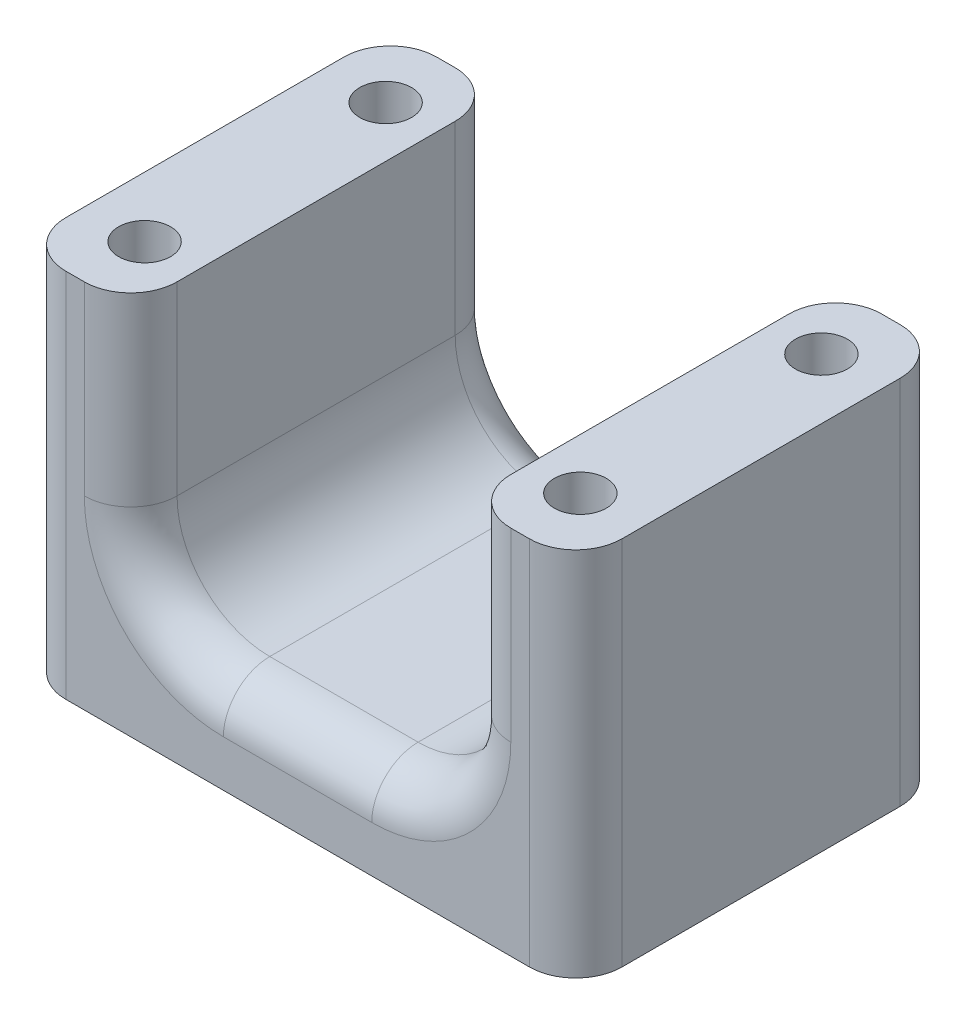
SolidWorks part; units mm, degrees
ref_plane "前视基准面" through (0, 0, 0) normal (0, 0, 1) x (1, 0, 0)
ref_plane "上视基准面" through (0, 0, 0) normal (0, 1, 0) x (1, 0, 0)
ref_plane "右视基准面" through (0, 0, 0) normal (1, 0, 0) x (0, 0, -1)
sketch "草图1" plane through (0, 0, 0) normal (0, 1, 0) x (1, 0, 0)
  line L1 (0, 0) -> (60, 0)
  line L2 (0, 0) -> (0, 40)
  line L3 (0, 40) -> (60, 40)
  line L4 (60, 0) -> (60, 40)
  dimension "D1" = 60
  dimension "D2" = 40
extrude "凸台-拉伸1" add sketch "草图1" along normal blind 40
sketch "草图2" plane through (0, 40, 0) normal (0, 1, 0) x (1, 0, 0)
  line L0 (60, 40) -> (0, 40) construction
  line L1 (12, 40) -> (48, 40)
  line L2 (12, 40) -> (12, 0)
  line L3 (12, 0) -> (48, 0)
  line L4 (48, 40) -> (48, 0)
  line L5 (0, 0) -> (60, 0) construction
  point P8 (30, 40)
  point P9 (30, 40)
  dimension "D1" = 36
  dimension "D2" = 0
extrude "切除-拉伸1" cut sketch "草图2" against normal blind 30
sketch "草图3" plane through (0, 40, 0) normal (0, 1, 0) x (1, 0, 0)
  line L0 (60, 0) -> (60, 40) construction
  line L1 (0, 40) -> (0, 0) construction
  line L2 (48, 40) -> (12, 40) construction
  line L3 (12, 0) -> (48, 0) construction
  circle A0 centre (6.5, 33) radius 2.8
  circle A1 centre (6.5, 7) radius 2.8
  circle A2 centre (53.5, 33) radius 2.8
  circle A3 centre (53.5, 7) radius 2.8
  point P10 (60, 20)
  point P13 (0, 20)
  point P16 (30, 40)
  point P19 (30, 0)
  dimension "D1" = 5.6
  dimension "D2" = 5.6
  dimension "D3" = 5.6
  dimension "D4" = 5.6
  dimension "D5" = 26
  dimension "D6" = 26
  dimension "D7" = 13
  dimension "D8" = 13
  dimension "D9" = 23.5
  dimension "D10" = 23.5
  dimension "D11" = 23.5
  dimension "D12" = 23.5
extrude "切除-拉伸2" cut sketch "草图3" against normal through all
fillet "圆角1" radius 10 2 edges at (48, 10, -20) (12, 10, -20)
fillet "圆角2" radius 5 14 edges at (48, 30, -40) (45.0711, 12.9289, -40) (12, 30, -40) (14.9289, 12.9289, -40) (12, 30, 0) (14.9289, 12.9289, 0) (48, 30, 0) (45.0711, 12.9289, 0) (0, 20, -40) (0, 20, 0) (60, 20, -40) (60, 20, 0) (30, 10, -40) (30, 10, 0)
